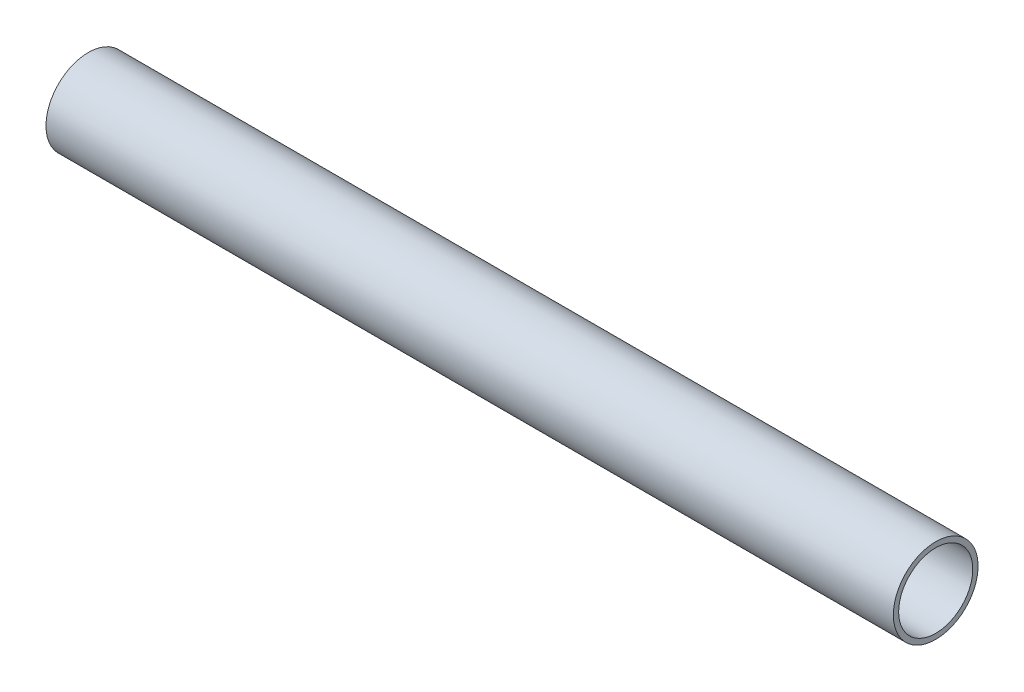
SolidWorks part; units mm, degrees
ref_plane "Plane1" through (0, 0, 0) normal (0, 0, 1) x (1, 0, 0)
ref_plane "Plane2" through (0, 0, 0) normal (0, 1, 0) x (1, 0, 0)
ref_plane "Plane3" through (0, 0, 0) normal (1, 0, 0) x (0, 0, -1)
sketch "Esquisse1" plane through (0, 0, 0) normal (0, 0, 1) x (1, 0, 0)
  line L0 (0, 0) -> (123.2563, 0) construction
  line L1 (0, 8) -> (160, 8)
  line L2 (0, 8) -> (0, 7)
  line L3 (160, 7) -> (0, 7)
  line L4 (160, 7) -> (160, 8)
  dimension "D1" = 1
  dimension "D2" = 160
  dimension "D3" = 8
revolve "Base-Révolution" add sketch "Esquisse1" angle 360 about L0
